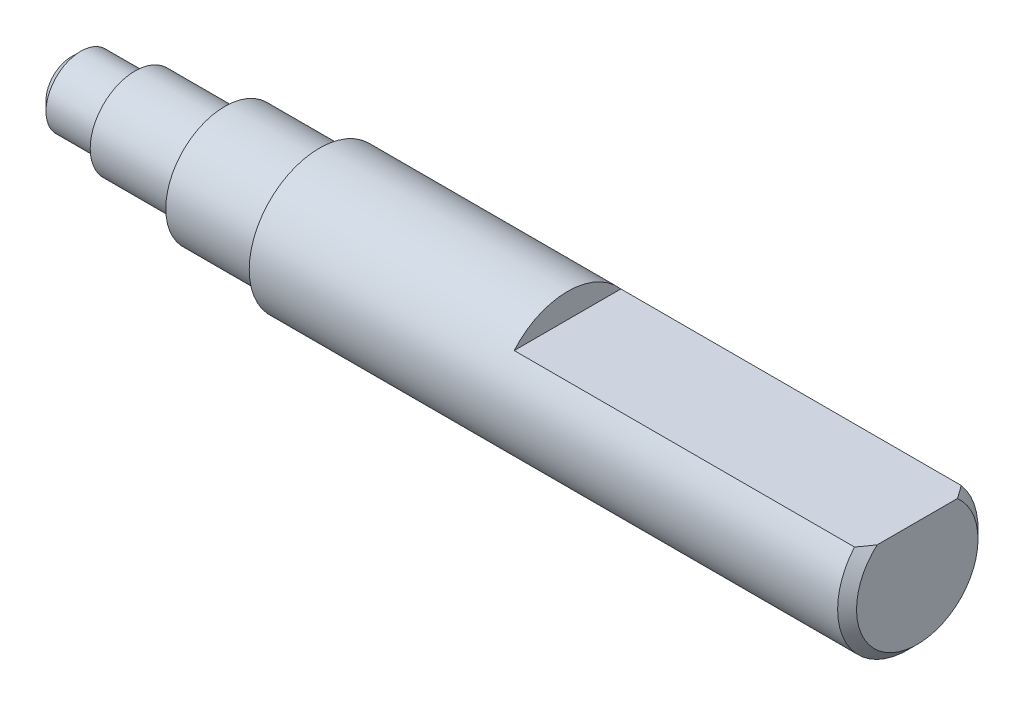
SolidWorks part; units mm, degrees
ref_plane "Front Plane" through (0, 0, 0) normal (0, 0, 1) x (1, 0, 0)
ref_plane "Top Plane" through (0, 0, 0) normal (0, 1, 0) x (1, 0, 0)
ref_plane "Right Plane" through (0, 0, 0) normal (1, 0, 0) x (0, 0, -1)
sketch "Sketch1" plane through (0, 0, 0) normal (0, 0, 1) x (1, 0, 0)
  line L0 (-168.1441, 0) -> (49831.8559, 0) construction
  line L1 (1.6335, 0) -> (-1.6335, 0) construction
  line L2 (0, 0) -> (0, 0.735)
  line L3 (0, -1.6335) -> (0, 1.6335) construction
  line L4 (0, 0.735) -> (1.35, 0.735)
  line L5 (1.35, 0.735) -> (1.35, 0.95)
  line L6 (1.35, 0.95) -> (3.25, 0.95)
  line L7 (3.25, 0.95) -> (3.25, 1.25)
  line L8 (3.25, 1.25) -> (5.25, 1.25)
  line L9 (5.25, 1.25) -> (5.25, 1.485)
  line L10 (5.25, 1.485) -> (17.9, 1.485)
  line L11 (17.9, 1.485) -> (17.9, 0)
  line L12 (17.9, 0) -> (0, 0)
  dimension "D1" = 2.97
  dimension "D2" = 1.47
  dimension "D3" = 1.9
  dimension "D4" = 2.5
  dimension "D5" = 12.65
  dimension "D6" = 1.35
  dimension "D7" = 2
  dimension "D8" = 17.9
revolve "Revolve1" add sketch "Sketch1" angle 360 about L0
sketch "Sketch3" plane through (17.9, 0, 0) normal (1, 0, 0) x (0, 0, -1)
  line L0 (-1.1287, 0.965) -> (1.1287, 0.965)
  line L1 (0, 1.6335) -> (0, -1.6335) construction
  circle A0 centre (0, 0) radius 1.485 construction
  arc A1 (1.1287, 0.965) -> (-1.1287, 0.965) centre (0, 0) ccw
  point P2 (0, -1.485)
  dimension "D1" = 2.45
extrude "Cut-Extrude1" cut sketch "Sketch3" against normal blind 7.4
chamfer "Chamfer1" distance 0.2 angle 45 2 edges at (0, 0, 0.735) (17.9, -1.485, 0)
